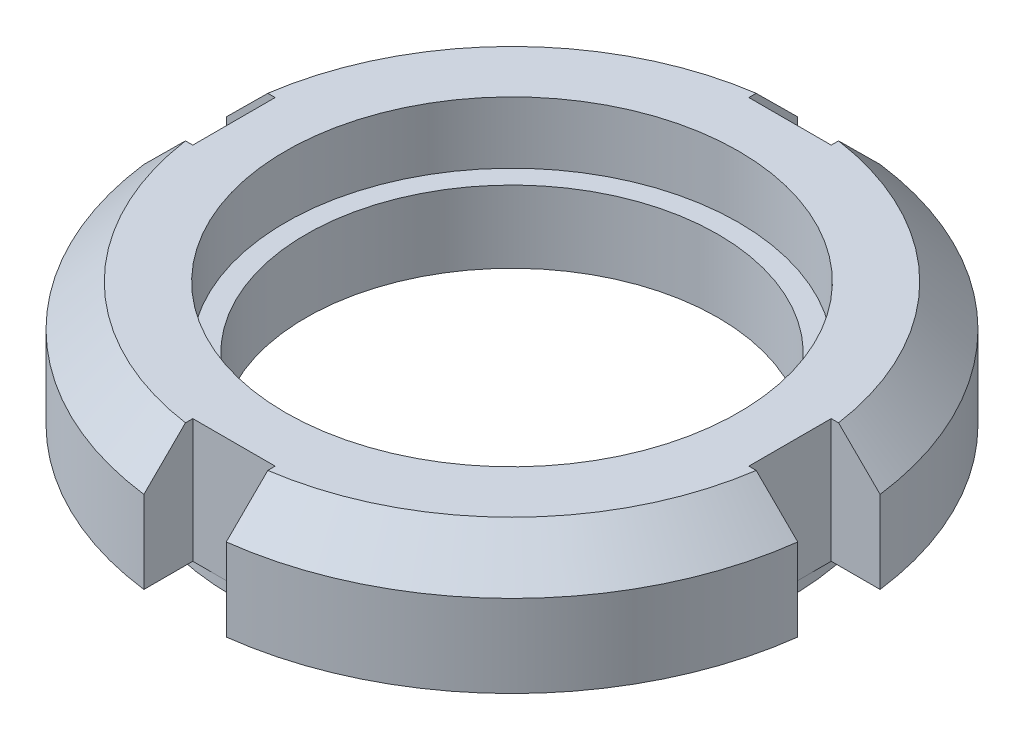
SolidWorks part; units mm, degrees
ref_plane "Face" through (0, 0, 0) normal (0, 0, 1) x (1, 0, 0)
ref_plane "Dessus" through (0, 0, 0) normal (0, 1, 0) x (1, 0, 0)
ref_plane "Droite" through (0, 0, 0) normal (1, 0, 0) x (0, 0, -1)
sketch "Esquisse9" plane through (0, 0, 0) normal (0, 0, 1) x (1, 0, 0)
  line L0 (0, 0) -> (0, 24.5751) construction
  line L1 (10, 0) -> (13.5, 0)
  line L2 (13.5, 0) -> (13.5, 0.5)
  line L3 (13.5, 0.5) -> (16, 0.5)
  line L4 (16, 0.5) -> (16, 4.5)
  line L5 (16, 4.5) -> (14, 6.5)
  line L6 (14, 6.5) -> (11, 6.5)
  line L7 (10, 3.5) -> (10, 0)
  line L8 (11, 6.5) -> (11, 3.5)
  line L9 (11, 3.5) -> (10, 3.5)
  dimension "D1" = 32
  dimension "D2" = 27
  dimension "D3" = 0.5
  dimension "D4" = 6.5
  dimension "D5" = 45
  dimension "D6" = 2
  dimension "D7" = 20
  dimension "D8" = 3
  dimension "D9" = 22
revolve "Révolution1" add sketch "Esquisse9" angle 360 about L0
sketch "Esquisse10" plane through (0, 6.5, 0) normal (0, 1, 0) x (-1, 0, 0)
  line L1 (-16, -2) -> (-13.5, -2)
  line L2 (-16, -2) -> (-16, 2)
  line L3 (-16, 2) -> (-13.5, 2)
  line L4 (-13.5, -2) -> (-13.5, 2)
  circle A0 centre (0, 0) radius 13.5 construction
  circle A1 centre (0, 0) radius 16 construction
  dimension "D1" = 2
  dimension "D2" = 2
extrude "Enlèv. mat.-Extru.1" cut sketch "Esquisse10" against normal through all
pattern_circular "Répétition circulaire1" count 4 over 360 about axis through (0, 0, 0) along (0, 1, 0) of "Enlèv. mat.-Extru.1"
